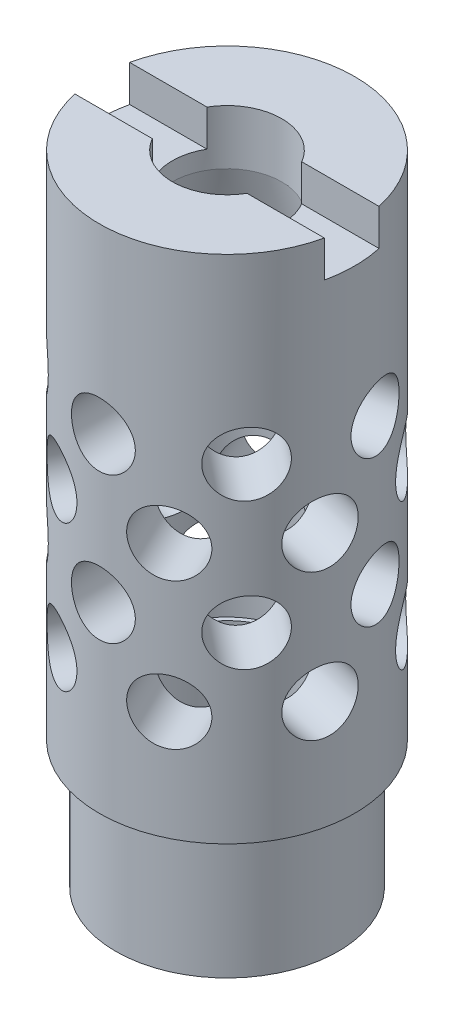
SolidWorks part; units mm, degrees
ref_plane "Front Plane" through (0, 0, 0) normal (0, 0, 1) x (1, 0, 0)
ref_plane "Top Plane" through (0, 0, 0) normal (0, 1, 0) x (1, 0, 0)
ref_plane "Right Plane" through (0, 0, 0) normal (1, 0, 0) x (0, 0, -1)
sketch "Sketch1" plane through (0, 0, 0) normal (0, 0, 1) x (1, 0, 0)
  line L0 (0, 0) -> (0, 65.8306) construction
  line L1 (2.3813, 27.7812) -> (2.3813, 25.4)
  line L2 (2.9845, 0) -> (4.845, 0)
  line L3 (5.5562, 5.5562) -> (5.5562, 27.7812)
  line L4 (5.5562, 27.7812) -> (2.3813, 27.7812)
  line L5 (2.3813, 25.4) -> (3.175, 21.6657)
  line L6 (3.175, 21.6657) -> (3.175, 7.9375)
  line L7 (5.5562, 5.5562) -> (4.845, 5.5562)
  line L8 (4.845, 5.5562) -> (4.845, 0)
  line L9 (3.175, 7.9375) -> (2.9845, 7.9375)
  line L10 (2.9845, 7.9375) -> (2.9845, 0)
  dimension "D1" = 4.7625
  dimension "D2" = 11.1125
  dimension "D3" = 27.7812
  dimension "D4" = 6.35
  dimension "D5" = 2.3813
  dimension "D6" = 12
  dimension "D7" = 0.7112
  dimension "D8" = 22.225
  dimension "D9" = 5.969
  dimension "D10" = 7.9375
revolve "Revolve1" add sketch "Sketch1" angle 360 about L0
hole_wizard "7/64 (0.10938) Diameter Hole1" positions "Sketch3" profile "Sketch5" hole size "7/64" standard "Ansi Inch"
sketch "Sketch3" plane through (0, 0, 0) normal (0, 0, 1) x (1, 0, 0)
  line L0 (5.5562, 27.7812) -> (-5.5562, 27.7812) construction
  line L1 (0, 21.6657) -> (0, 7.9375) construction
  point P0 (0, 19.8438)
  point P7 (0, 13.4938)
  dimension "D1" = 7.9375
  dimension "D2" = 6.35
sketch "Sketch5" plane through (0, 19.8438, 0) normal (1, 0, 0) x (0, 1, 0)
  line L0 (0, 0) -> (0, 5.5562)
  line L1 (0, 5.5562) -> (1.3891, 5.5562)
  line L2 (1.3891, 5.5562) -> (1.3891, 0)
  line L5 (1.3891, 0) -> (0, 0)
  line L11 (0, -6.35) -> (0, 107.95) construction
  dimension "Thru Hole Dia." = 2.7783
  dimension "Thru Hole Depth" = 5.5562
sketch "Sketch6" plane through (0, 27.7812, 0) normal (0, 1, 0) x (1, 0, 0)
  line L0 (-5.5562, 1.1906) -> (5.5562, 1.1906)
  line L1 (5.5562, 1.1906) -> (5.5562, -1.1906)
  line L2 (5.5562, -1.1906) -> (-5.5562, -1.1906)
  line L3 (-5.5562, -1.1906) -> (-5.5562, 1.1906)
  circle A0 centre (0, 0) radius 5.5562 construction
  point P6 (-5.5562, 0)
  dimension "D1" = 2.3813
extrude "Extrude1" cut sketch "Sketch6" against normal blind 1.5875
hole_wizard "7/64 (0.10938) Diameter Hole2" positions "Sketch8" profile "Sketch9" hole size "7/64" standard "Ansi Inch"
sketch "Sketch8" plane through (0, -26.9875, 0) normal (0, 0, 1) x (1, 0, 0)
  line L1 (0, 48.6532) -> (0, 34.925) construction
  point P0 (0, 43.6563)
  point P9 (0, 37.3063)
  dimension "D1" = 3.175
  dimension "D2" = 6.35
sketch "Sketch9" plane through (0, 16.6688, 0) normal (1, 0, 0) x (0, -1, 0)
  line L0 (0, 0) -> (0, 5.5562)
  line L1 (0, 5.5562) -> (1.3891, 5.5562)
  line L2 (1.3891, 5.5562) -> (1.3891, 0)
  line L5 (1.3891, 0) -> (0, 0)
  line L11 (0, -6.35) -> (0, 107.95) construction
  dimension "Thru Hole Dia." = 2.7783
  dimension "Thru Hole Depth" = 5.5562
pattern_circular "CirPattern1" count 7 over 360 about axis through (0, 25.4, 0) along (0, -1, 0) of "7/64 (0.10938) Diameter Hole1", "7/64 (0.10938) Diameter Hole2"
